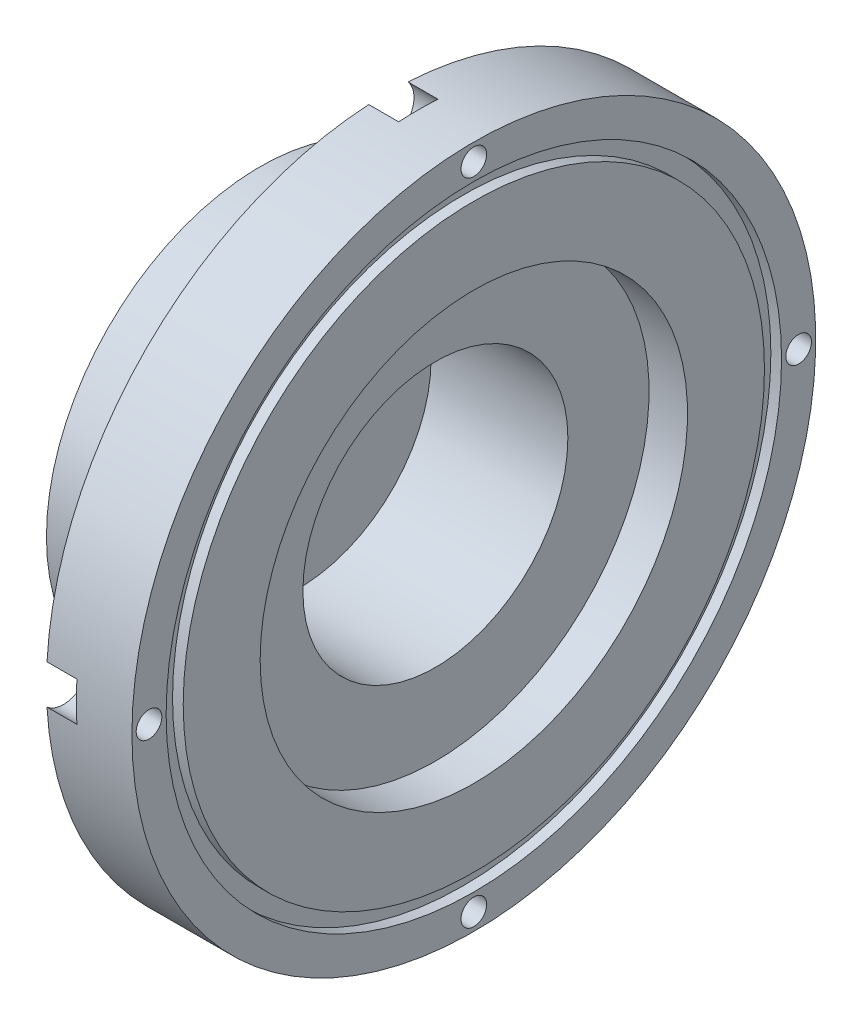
SolidWorks part; units mm, degrees
ref_plane "Front Plane" through (0, 0, 0) normal (0, 0, 1) x (1, 0, 0)
ref_plane "Top Plane" through (0, 0, 0) normal (0, 1, 0) x (1, 0, 0)
ref_plane "Right Plane" through (0, 0, 0) normal (1, 0, 0) x (0, 0, -1)
sketch "Sketch1" plane through (0, 0, 0) normal (0, 0, 1) x (1, 0, 0)
  line L1 (20.5, 15.5) -> (20.5, 25)
  line L2 (20.5, 25) -> (25, 25)
  line L3 (25, 25) -> (25, 34)
  line L4 (25, 34) -> (23.75, 34)
  line L5 (23.75, 34) -> (23.75, 36)
  line L6 (23.75, 36) -> (25, 36)
  line L7 (25, 36) -> (25, 40)
  line L8 (25, 40) -> (15, 40)
  line L9 (15, 40) -> (15, 25)
  line L10 (15, 25) -> (0, 25)
  line L12 (0, 25) -> (0, 0)
  line L13 (0, 0) -> (4.5, 0)
  line L14 (4.5, 0) -> (4.5, 15.5)
  line L15 (4.5, 15.5) -> (20.5, 15.5)
  point P0 (22.75, 25)
  dimension "D1" = 15.5
  dimension "D2" = 16
  dimension "D3" = 25
  dimension "D4" = 4.5
  dimension "D5" = 40
  dimension "D6" = 10
  dimension "D7" = 2
  dimension "D8" = 4
  dimension "D9" = 1.25
  dimension "D10" = 25
  dimension "D11" = 25
revolve "Revolve1" add sketch "Sketch1" angle 360 about L13
sketch "Sketch2" plane through (15, 0, 0) normal (-1, 0, 0) x (0, 0, 1)
  circle A0 centre (0, 38) radius 1.5
  dimension "D1" = 3
  dimension "D2" = 38
extrude "Cut-Extrude1" cut sketch "Sketch2" against normal up to next
sketch "Sketch3" plane through (15, 0, 0) normal (-1, 0, 0) x (0, 0, 1)
  circle A0 centre (0, 38) radius 3
  dimension "D1" = 6
extrude "Cut-Extrude2" cut sketch "Sketch3" against normal blind 3.5
pattern_circular "CirPattern1" count 4 over 360 about axis through (0, 0, 0) along (1, 0, 0) of "Cut-Extrude1", "Cut-Extrude2"
hole_wizard "CBORE for M5 Hex Head Bolt1" positions "3DSketch1" profile "Sketch4" counterbore size "M5" standard "ANSI Metric"
sketch3d "3DSketch1"
  line L0 (0, 0, 0) -> (0, 25, 0) construction
  line L1 (0, 25, 0) -> (9.996, 24.9984, 0.2811) construction
  circle A0 centre (0, 0, 0) radius 25 construction
  point P0 (9.996, 24.9984, 0.2811)
  point P12 (-25, 0, 0)
  dimension "D1" = 10
sketch "Sketch4" plane through (9.996, 24.9984, 0.2811) normal (1, 0, 0) x (0, -0.0112, 0.9999)
  line L0 (0, 0) -> (0, 9.5)
  line L1 (0, 9.5) -> (2.75, 9.5)
  line L3 (2.75, 9.5) -> (2.75, 1.2)
  line L4 (2.75, 1.2) -> (4.5, 1.2)
  line L5 (4.5, 1.2) -> (4.5, 0)
  line L7 (4.5, 0) -> (0, 0)
  line L11 (0, -6.35) -> (0, 107.95) construction
  dimension "Thru Hole Dia." = 5.5
  dimension "Thru Hole Depth" = 9.5
  dimension "C'Bore Dia." = 9
  dimension "C'Bore Depth" = 1.2
